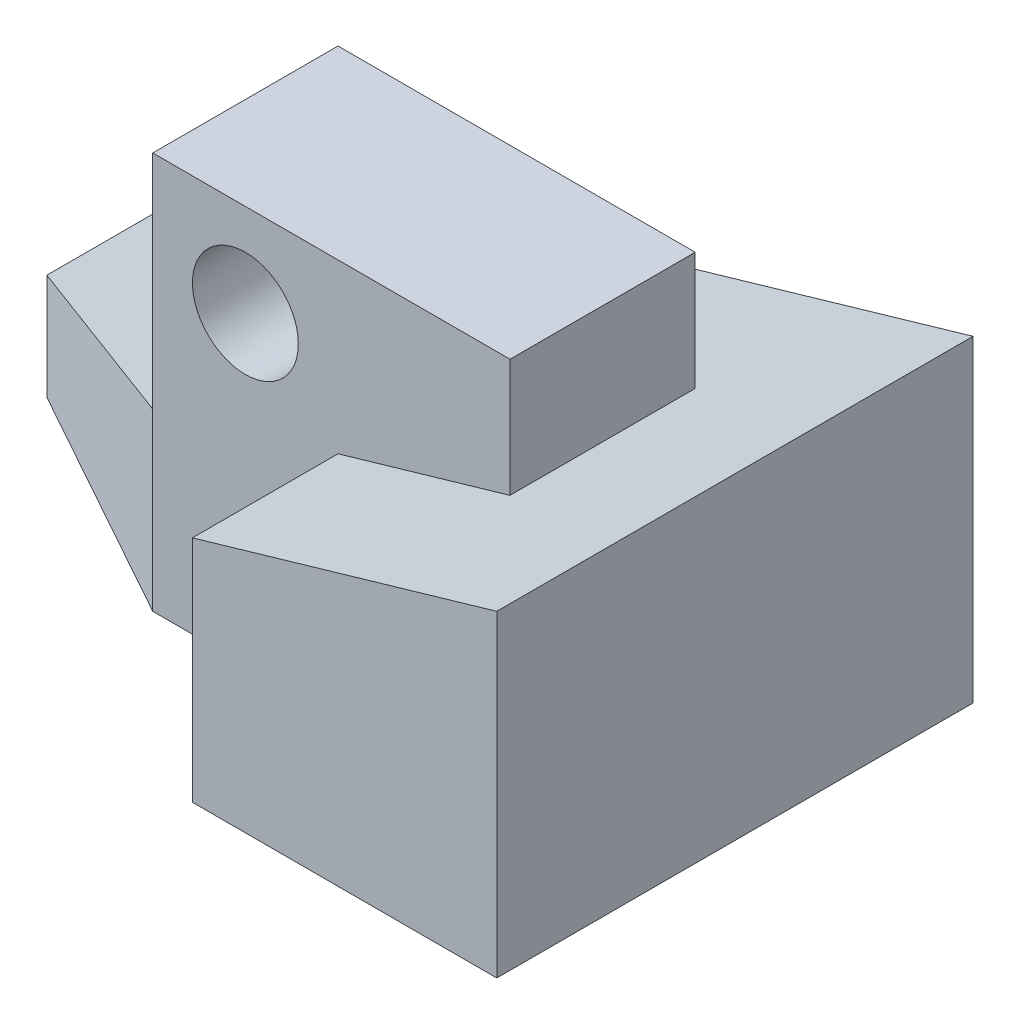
SolidWorks part; units mm, degrees
ref_plane "前视基准面" through (0, 0, 0) normal (0, 0, 1) x (1, 0, 0)
ref_plane "上视基准面" through (0, 0, 0) normal (0, 1, 0) x (1, 0, 0)
ref_plane "右视基准面" through (0, 0, 0) normal (1, 0, 0) x (0, 0, -1)
sketch "草图1" plane through (0, 0, 0) normal (0, 1, 0) x (1, 0, 0)
  line L0 (0, 0) -> (55, 0)
  line L1 (55, 0) -> (55, -36)
  line L2 (55, -36) -> (32, -36)
  line L3 (32, -36) -> (32, -25)
  line L4 (32, -25) -> (18, -25)
  line L5 (18, -25) -> (0, -15)
  line L6 (0, -15) -> (0, 0)
  dimension "D1" = 55
  dimension "D2" = 36
  dimension "D3" = 23
  dimension "D4" = 14
  dimension "D5" = 11
  dimension "D6" = 15
extrude "拉伸1" add sketch "草图1" along normal blind 24
sketch "草图2" plane through (0, 0, 36) normal (0, 0, 1) x (1, 0, 0)
  line L0 (55, 24) -> (0, 8)
  line L1 (0, 24) -> (0, 0) construction
  line L2 (0, 8) -> (0, 24)
  line L3 (0, 24) -> (55, 24)
extrude "切除-拉伸1" cut sketch "草图2" against normal through all
ref_plane "基准面1" through (0, 30, 0) normal (0, -1, 0) x (1, 0, 0)
sketch "草图3" plane through (0, 30, 0) normal (0, -1, 0) x (1, 0, 0)
  line L1 (18, 25) -> (45, 25)
  line L2 (18, 25) -> (18, 11)
  line L3 (18, 11) -> (45, 11)
  line L4 (45, 25) -> (45, 11)
extrude "拉伸2" add sketch "草图3" along normal up to next
sketch "草图4" plane through (0, 0, 25) normal (0, 0, 1) x (1, 0, 0)
  line L0 (-19.8, 30) -> (19.8, 30) construction
  line L1 (18, 13.2364) -> (18, 30) construction
  circle A0 centre (25, 23) radius 4
  dimension "D1" = 7
  dimension "D2" = 7
extrude "切除-拉伸2" cut sketch "草图4" against normal through all
